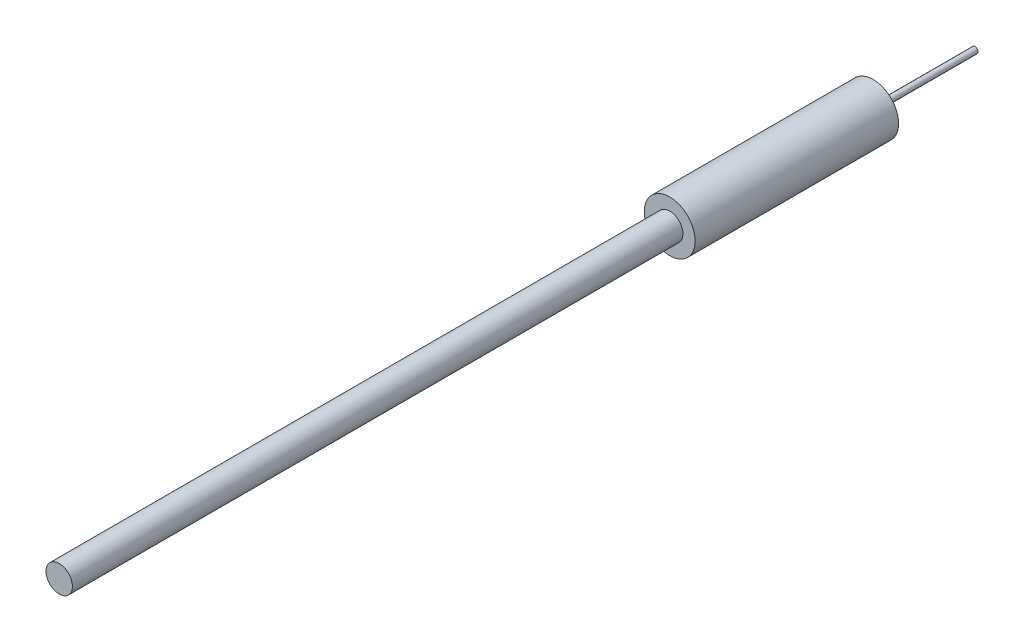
SolidWorks part; units mm, degrees
ref_plane "前视基准面" through (0, 0, 0) normal (0, 0, 1) x (1, 0, 0)
ref_plane "上视基准面" through (0, 0, 0) normal (0, 1, 0) x (1, 0, 0)
ref_plane "右视基准面" through (0, 0, 0) normal (1, 0, 0) x (0, 0, -1)
sketch "草图1" plane through (0, 0, 0) normal (0, 0, 1) x (1, 0, 0)
  circle A0 centre (0, 0) radius 1.25
  dimension "D1" = 2.5
extrude "凸台-拉伸1" add sketch "草图1" along normal blind 10
sketch "草图2" plane through (0, 0, 0) normal (0, 0, -1) x (-1, 0, 0)
  circle A0 centre (0, 0) radius 0.15
  dimension "D1" = 0.3
extrude "凸台-拉伸2" add sketch "草图2" along normal blind 5
sketch "草图3" plane through (0, 0, 10) normal (0, 0, 1) x (1, 0, 0)
  circle A0 centre (0, 0) radius 0.65
  dimension "D1" = 1.3
extrude "凸台-拉伸3" add sketch "草图3" along normal blind 30
sketch "草图4" plane through (0, 0, -5) normal (0, 0, -1) x (-1, 0, 0)
  circle A0 centre (0, 0) radius 0.0625
  circle A1 centre (0, 0) radius 0.0675
  dimension "D1" = 0.135
  dimension "D2" = 0.125
extrude "切除-拉伸1" cut sketch "草图4" against normal blind 0.1
